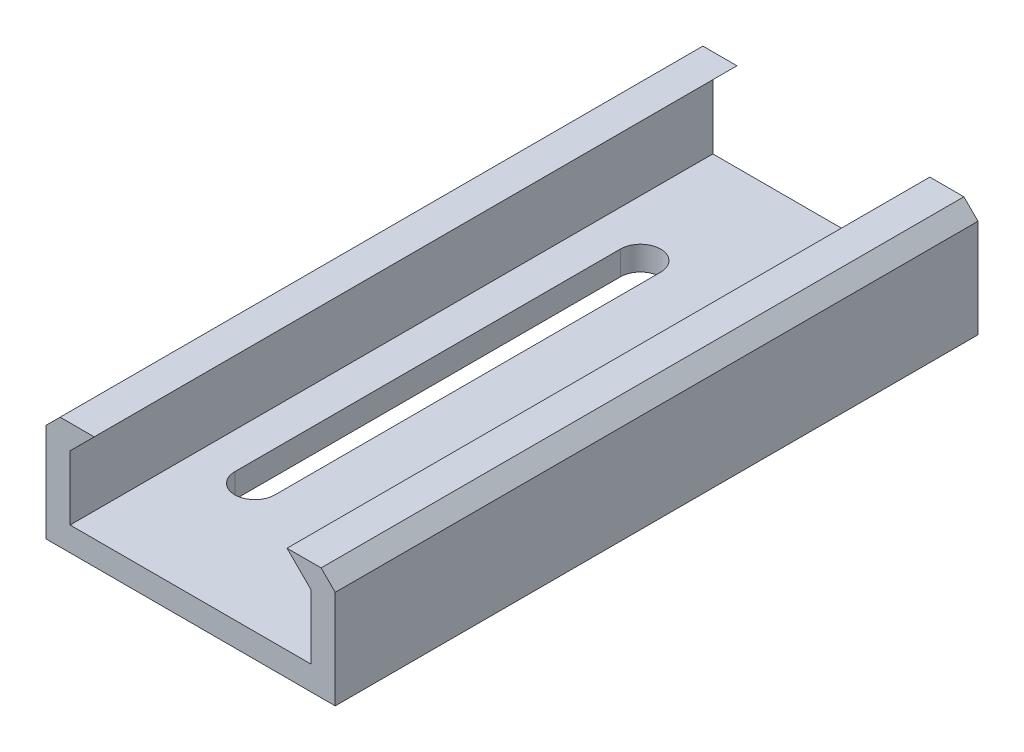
SolidWorks part; units mm, degrees
ref_plane "Front" through (0, 0, 0) normal (0, 0, 1) x (1, 0, 0)
ref_plane "Top" through (0, 0, 0) normal (0, 1, 0) x (1, 0, 0)
ref_plane "Right" through (0, 0, 0) normal (1, 0, 0) x (0, 0, -1)
sketch "Sketch1" plane through (0, 0, 0) normal (0, 0, 1) x (1, 0, 0)
  line L0 (-47.625, 25.4) -> (-38.1, 34.925)
  line L1 (-47.625, 0) -> (-47.625, 25.4)
  line L2 (-47.625, 0) -> (47.625, 0)
  line L3 (-31.848, 34.925) -> (27.098, 34.925) construction
  line L4 (47.625, 0) -> (47.625, 25.4)
  line L5 (38.1, 34.925) -> (47.625, 25.4)
  line L6 (-57.15, 29.3454) -> (-51.5704, 34.925)
  line L7 (-57.15, -9.525) -> (-57.15, 29.3454)
  line L8 (-57.15, -9.525) -> (57.15, -9.525)
  line L9 (57.15, -9.525) -> (57.15, 29.3454)
  line L10 (51.5704, 34.925) -> (57.15, 29.3454)
  line L11 (-51.5704, 34.925) -> (-38.1, 34.925)
  line L13 (38.1, 34.925) -> (51.5704, 34.925)
  dimension "D1" = 34.925
  dimension "D2" = 95.25
  dimension "D3" = 76.2
  dimension "D5" = 45
  dimension "D4" = 45
  dimension "D6" = 9.525
extrude "Base-Extrude" add sketch "Sketch1" against normal blind 254
sketch "Sketch2" plane through (-17.3724, -9.525, 51.1362) normal (0, -1, 0) x (0, 0, 1)
  line L0 (-254.3362, -42.7724) -> (-101.9362, -42.7724) construction
  line L1 (-178.1362, -34.8349) -> (-178.1362, -50.7099) construction
  line L2 (-254.3362, -34.8349) -> (-101.9362, -34.8349)
  line L3 (-101.9362, -50.7099) -> (-254.3362, -50.7099)
  line L7 (-51.1362, 39.7776) -> (-51.1362, -74.5224) construction
  line L8 (-51.1362, -17.3724) -> (-480.279, -17.3724) construction
  line L9 (-254.3362, 0.0901) -> (-101.9362, 0.0901)
  line L10 (-101.9362, 15.9651) -> (-254.3362, 15.9651)
  arc A0 (-101.9362, -34.8349) -> (-101.9362, -50.7099) centre (-101.9362, -42.7724) cw
  arc A1 (-254.3362, -34.8349) -> (-254.3362, -50.7099) centre (-254.3362, -42.7724) ccw
  arc A2 (-101.9362, 0.0901) -> (-101.9362, 15.9651) centre (-101.9362, 8.0276) ccw
  arc A3 (-254.3362, 0.0901) -> (-254.3362, 15.9651) centre (-254.3362, 8.0276) cw
  point P12 (-178.1362, -42.7724)
  dimension "D1" = 50.8
  dimension "D2" = 50.8
  dimension "Slot width" = 15.875
  dimension "Slot length" = 152.4
extrude "Cut-Extrude1" cut sketch "Sketch2" against normal through all
